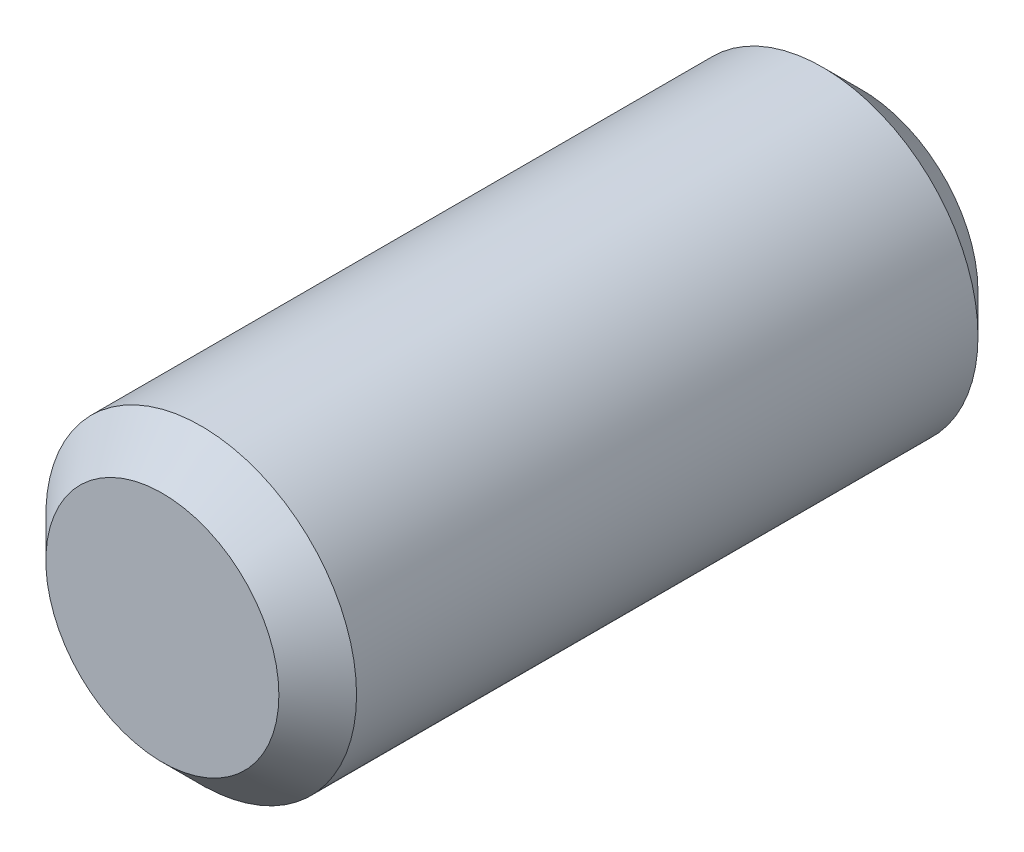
SolidWorks part; units mm, degrees
ref_plane "Plan de face" through (0, 0, 0) normal (0, 0, 1) x (1, 0, 0)
ref_plane "Plan de dessus" through (0, 0, 0) normal (0, 1, 0) x (1, 0, 0)
ref_plane "Plan de droite" through (0, 0, 0) normal (1, 0, 0) x (0, 0, -1)
sketch "Esquisse1" plane through (0, 0, 0) normal (0, 0, 1) x (1, 0, 0)
  circle A0 centre (0, 0) radius 2
  dimension "D1" = 4
extrude "Extrusion1" add sketch "Esquisse1" along normal blind 9
chamfer "Chanfrein1" distance 0.5 angle 45 2 edges at (2, 0, 0) (2, 0, 9)
